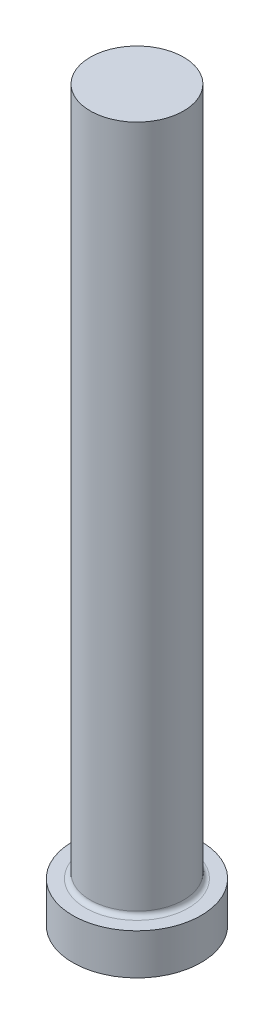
SolidWorks part; units mm, degrees
ref_plane "Plano frontal" through (0, 0, 0) normal (0, 0, 1) x (1, 0, 0)
ref_plane "Plano superior" through (0, 0, 0) normal (0, 1, 0) x (1, 0, 0)
ref_plane "Plano direito" through (0, 0, 0) normal (1, 0, 0) x (0, 0, -1)
sketch "Esboço1" plane through (0, 0, 0) normal (0, 0, 1) x (1, 0, 0)
  line L0 (0, 0) -> (11, 0)
  line L1 (11, 0) -> (11, 7)
  line L2 (11, 7) -> (8.8, 7)
  line L3 (8, 7.8) -> (8, 125)
  line L4 (8, 125) -> (0, 125)
  line L5 (0, 125) -> (0, 0) construction
  line L6 (0, 0) -> (0, 125)
  arc A0 (8.8, 7) -> (8, 7.8) centre (8.8, 7.8) cw
  dimension "D3" = 0.8
  dimension "D1" = 22
  dimension "D2" = 16
  dimension "D4" = 7
  dimension "D5" = 125
revolve "Revolução1" add sketch "Esboço1" angle 360 about L5
sketch "Esboço2"
  dimension "D1" = 0.825
  dimension "D2" = 1.925
  dimension "D3" = 1.2375
  dimension "D4" = 5.9125
wrap "Envolver1" sketch "Esboço2" source sketch "Esboço2" thickness 0.1 parameters "D1"=0.1
